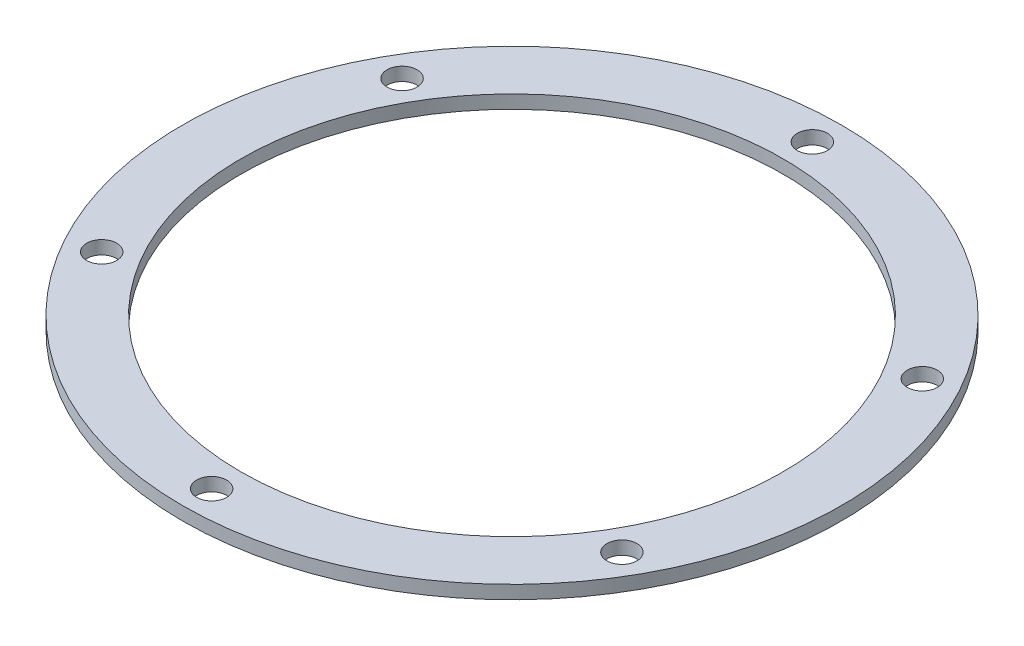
SolidWorks part; units mm, degrees
ref_plane "Plan de face" through (0, 0, 0) normal (0, 0, 1) x (1, 0, 0)
ref_plane "Plan de dessus" through (0, 0, 0) normal (0, 1, 0) x (1, 0, 0)
ref_plane "Plan de droite" through (0, 0, 0) normal (1, 0, 0) x (0, 0, -1)
sketch "Esquisse1" plane through (0, 0, 0) normal (0, 0, 1) x (1, 0, 0)
  line L0 (0, 12.5903) -> (0, -16.787) construction
  line L1 (-197.5, 1.0054) -> (-162.5, 1.0054)
  line L2 (-162.5, 1.0054) -> (-162.5, -6.9946)
  line L3 (-162.5, -6.9946) -> (-197.5, -6.9946)
  line L4 (-197.5, -6.9946) -> (-197.5, 1.0054)
  dimension "D1" = 162.5
  dimension "D2" = 197.5
  dimension "D3" = 8
revolve "Révolution1" add sketch "Esquisse1" angle 360 about L0
sketch "Esquisse2" plane through (0, 1.0054, 0) normal (0, 1, 0) x (1, 0, 0)
  line L0 (0, 218.5398) -> (0, -28.7282) construction
  line L1 (0, 0) -> (0, 180) construction
  line L2 (0, 0) -> (155.8846, 90) construction
  circle A0 centre (0, 0) radius 180 construction
  circle A1 centre (0, 180) radius 9
  circle A2 centre (155.8846, 90) radius 9
  circle A3 centre (155.8846, -90) radius 9
  circle A4 centre (0, -180) radius 9
  circle A5 centre (-155.8846, -90) radius 9
  circle A6 centre (-155.8846, 90) radius 9
  dimension "D1" = 360
  dimension "D2" = 18
  dimension "D3" = 60
extrude "Extrusion1" cut sketch "Esquisse2" against normal blind 10
